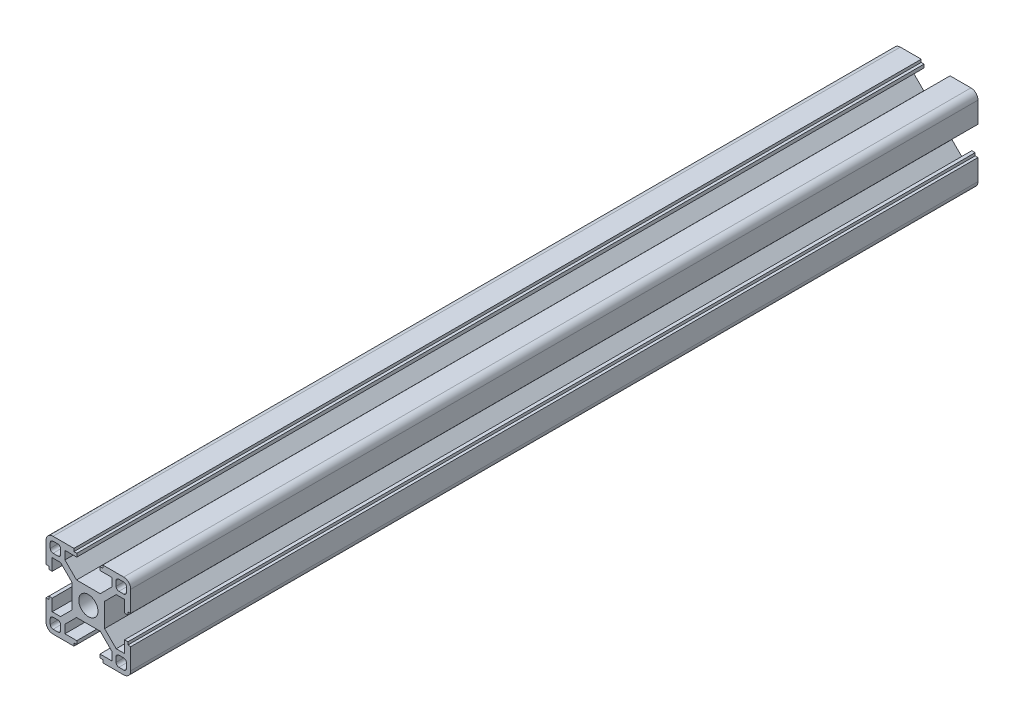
SolidWorks part; units mm, degrees
ref_plane "前视基准面" through (0, 0, 0) normal (0, 0, 1) x (1, 0, 0)
ref_plane "上视基准面" through (0, 0, 0) normal (0, 1, 0) x (1, 0, 0)
ref_plane "右视基准面" through (0, 0, 0) normal (1, 0, 0) x (0, 0, -1)
sketch "草图1" plane through (0, 0, 0) normal (0, 0, 1) x (1, 0, 0)
  line B0 (-9.8, 10.8) -> (-9.8, 12.5)
  line B1 (-10.8, 13.5) -> (-12.5, 13.5)
  line B2 (-13.5, 12.5) -> (-13.5, 10.8)
  line B3 (-12.5, 9.8) -> (-10.8, 9.8)
  line B4 (9.8, 12.5) -> (9.8, 10.8)
  line B5 (10.8, 9.8) -> (12.5, 9.8)
  line B6 (13.5, 10.8) -> (13.5, 12.5)
  line B7 (12.5, 13.5) -> (10.8, 13.5)
  line B8 (9.8, -10.8) -> (9.8, -12.5)
  line B9 (10.8, -13.5) -> (12.5, -13.5)
  line B10 (13.5, -12.5) -> (13.5, -10.8)
  line B11 (12.5, -9.8) -> (10.8, -9.8)
  line B12 (-9.8, -12.5) -> (-9.8, -10.8)
  line B13 (-10.8, -9.8) -> (-12.5, -9.8)
  line B14 (-13.5, -10.8) -> (-13.5, -12.5)
  line B15 (-12.5, -13.5) -> (-10.8, -13.5)
  line B16 (-12.5, -15) -> (-5.1, -15)
  line B17 (-5.1, -15) -> (-5.1, -14)
  line B18 (-5.1, -14) -> (-4.1, -14)
  line B19 (-4.1, -14) -> (-4.1, -12.8)
  line B20 (-4.1, -12.8) -> (-8.3, -12.8)
  line B21 (-8.3, -12.8) -> (-8.3, -9.8556)
  line B22 (-8.3, -9.8556) -> (-4.1944, -5.75)
  line B23 (-4.1944, -5.75) -> (0, -5.75)
  line B24 (0, -5.75) -> (4.1944, -5.75)
  line B25 (4.1944, -5.75) -> (8.3, -9.8556)
  line B26 (8.3, -9.8556) -> (8.3, -12.8)
  line B27 (8.3, -12.8) -> (4.1, -12.8)
  line B28 (4.1, -12.8) -> (4.1, -14)
  line B29 (4.1, -14) -> (5.1, -14)
  line B30 (5.1, -14) -> (5.1, -15)
  line B31 (5.1, -15) -> (12.5, -15)
  line B32 (15, -12.5) -> (15, -5.1)
  line B33 (15, -5.1) -> (14, -5.1)
  line B34 (14, -5.1) -> (14, -4.1)
  line B35 (14, -4.1) -> (12.8, -4.1)
  line B36 (12.8, -4.1) -> (12.8, -8.3)
  line B37 (12.8, -8.3) -> (9.8556, -8.3)
  line B38 (9.8556, -8.3) -> (5.75, -4.1944)
  line B39 (5.75, -4.1944) -> (5.75, 0)
  line B40 (5.75, 0) -> (5.75, 4.1944)
  line B41 (5.75, 4.1944) -> (9.8556, 8.3)
  line B42 (9.8556, 8.3) -> (12.8, 8.3)
  line B43 (12.8, 8.3) -> (12.8, 4.1)
  line B44 (12.8, 4.1) -> (14, 4.1)
  line B45 (14, 4.1) -> (14, 5.1)
  line B46 (14, 5.1) -> (15, 5.1)
  line B47 (15, 5.1) -> (15, 12.5)
  line B48 (12.5, 15) -> (5.1, 15)
  line B49 (5.1, 15) -> (5.1, 14)
  line B50 (5.1, 14) -> (4.1, 14)
  line B51 (4.1, 14) -> (4.1, 12.8)
  line B52 (4.1, 12.8) -> (8.3, 12.8)
  line B53 (8.3, 12.8) -> (8.3, 9.8556)
  line B54 (8.3, 9.8556) -> (4.1944, 5.75)
  line B55 (4.1944, 5.75) -> (0, 5.75)
  line B56 (0, 5.75) -> (-4.1944, 5.75)
  line B57 (-4.1944, 5.75) -> (-8.3, 9.8556)
  line B58 (-8.3, 9.8556) -> (-8.3, 12.8)
  line B59 (-8.3, 12.8) -> (-4.1, 12.8)
  line B60 (-4.1, 12.8) -> (-4.1, 14)
  line B61 (-4.1, 14) -> (-5.1, 14)
  line B62 (-5.1, 14) -> (-5.1, 15)
  line B63 (-5.1, 15) -> (-12.5, 15)
  line B64 (-15, 12.5) -> (-15, 5.1)
  line B65 (-15, 5.1) -> (-14, 5.1)
  line B66 (-14, 5.1) -> (-14, 4.1)
  line B67 (-14, 4.1) -> (-12.8, 4.1)
  line B68 (-12.8, 4.1) -> (-12.8, 8.3)
  line B69 (-12.8, 8.3) -> (-9.8556, 8.3)
  line B70 (-9.8556, 8.3) -> (-5.75, 4.1944)
  line B71 (-5.75, 4.1944) -> (-5.75, 0)
  line B72 (-5.75, 0) -> (-5.75, -4.1944)
  line B73 (-5.75, -4.1944) -> (-9.8556, -8.3)
  line B74 (-9.8556, -8.3) -> (-12.8, -8.3)
  line B75 (-12.8, -8.3) -> (-12.8, -4.1)
  line B76 (-12.8, -4.1) -> (-14, -4.1)
  line B77 (-14, -4.1) -> (-14, -5.1)
  line B78 (-14, -5.1) -> (-15, -5.1)
  line B79 (-15, -5.1) -> (-15, -12.5)
  arc B80 (0, 3.4) -> (-3.4, 0) centre (0, 0) ccw
  arc B81 (-3.4, 0) -> (0, -3.4) centre (0, 0) ccw
  arc B82 (0, -3.4) -> (3.4, 0) centre (0, 0) ccw
  arc B83 (3.4, 0) -> (0, 3.4) centre (0, 0) ccw
  arc B84 (-10.8, 9.8) -> (-9.8, 10.8) centre (-10.8, 10.8) ccw
  arc B85 (-9.8, 12.5) -> (-10.8, 13.5) centre (-10.8, 12.5) ccw
  arc B86 (-12.5, 13.5) -> (-13.5, 12.5) centre (-12.5, 12.5) ccw
  arc B87 (-13.5, 10.8) -> (-12.5, 9.8) centre (-12.5, 10.8) ccw
  arc B88 (9.8, 10.8) -> (10.8, 9.8) centre (10.8, 10.8) ccw
  arc B89 (12.5, 9.8) -> (13.5, 10.8) centre (12.5, 10.8) ccw
  arc B90 (13.5, 12.5) -> (12.5, 13.5) centre (12.5, 12.5) ccw
  arc B91 (10.8, 13.5) -> (9.8, 12.5) centre (10.8, 12.5) ccw
  arc B92 (10.8, -9.8) -> (9.8, -10.8) centre (10.8, -10.8) ccw
  arc B93 (9.8, -12.5) -> (10.8, -13.5) centre (10.8, -12.5) ccw
  arc B94 (12.5, -13.5) -> (13.5, -12.5) centre (12.5, -12.5) ccw
  arc B95 (13.5, -10.8) -> (12.5, -9.8) centre (12.5, -10.8) ccw
  arc B96 (-9.8, -10.8) -> (-10.8, -9.8) centre (-10.8, -10.8) ccw
  arc B97 (-12.5, -9.8) -> (-13.5, -10.8) centre (-12.5, -10.8) ccw
  arc B98 (-13.5, -12.5) -> (-12.5, -13.5) centre (-12.5, -12.5) ccw
  arc B99 (-10.8, -13.5) -> (-9.8, -12.5) centre (-10.8, -12.5) ccw
  arc B100 (12.5, -15) -> (15, -12.5) centre (12.5, -12.5) ccw
  arc B101 (15, 12.5) -> (12.5, 15) centre (12.5, 12.5) ccw
  arc B102 (-12.5, 15) -> (-15, 12.5) centre (-12.5, 12.5) ccw
  arc B103 (-15, -12.5) -> (-12.5, -15) centre (-12.5, -12.5) ccw
sketch_block_instance "A$C196F5D3F-1"
sketch_block "A$C196F5D3F"
extrude "凸台-拉伸1" add sketch "草图1" along normal mid plane 300
